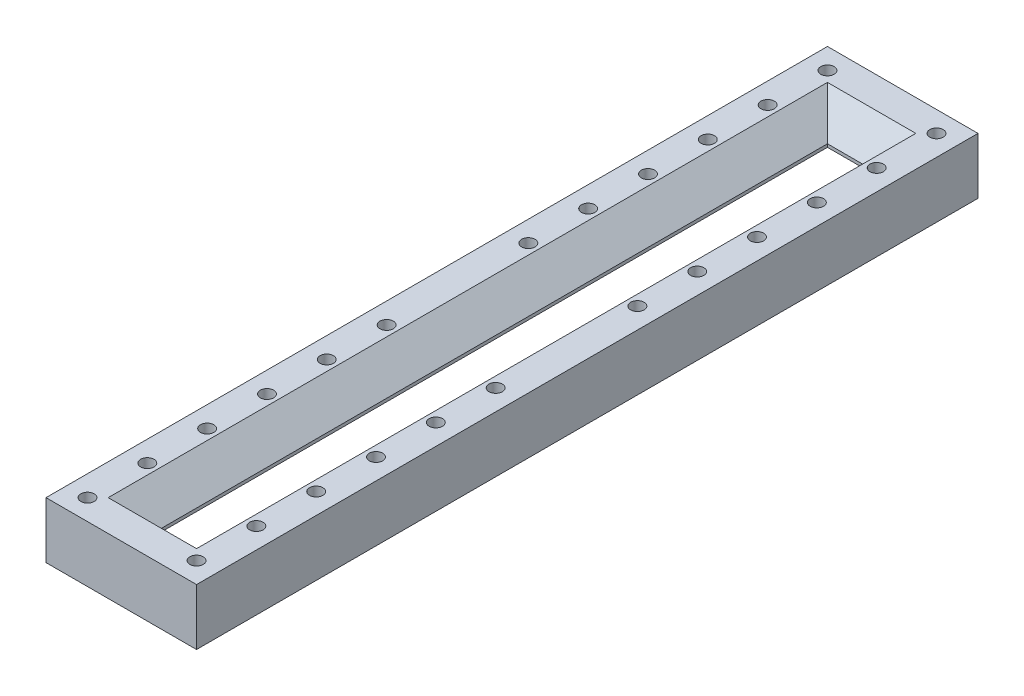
SolidWorks part; units mm, degrees
ref_plane "Front Plane" through (0, 0, 0) normal (1, 0, 0) x (0, 1, 0)
ref_plane "Top Plane" through (0, 0, 0) normal (0, 0, 1) x (0, 1, 0)
ref_plane "Right Plane" through (0, 0, 0) normal (0, 1, 0) x (-1, 0, 0)
sketch "beam" plane through (0, 0, 0) normal (0, 1, 0) x (-1, 0, 0)
  line L1 (-76.2, 1500) -> (76.2, 1500)
  line L2 (-76.2, 1500) -> (-76.2, -1500)
  line L3 (-76.2, -1500) -> (76.2, -1500)
  line L4 (76.2, 1500) -> (76.2, -1500)
  line L5 (-76.2, 1500) -> (76.2, -1500) construction
  line L6 (-76.2, -1500) -> (76.2, 1500) construction
  point P0 (0, 0)
  dimension "D1" = 3000
  dimension "D2" = 152.4
sketch "Sketch3" plane through (0, 0, 0) normal (0, 1, 0) x (-1, 0, 0)
  line L1 (-215.9, 1639.7) -> (215.9, 1639.7) construction
  line L2 (-215.9, 1639.7) -> (-215.9, -1639.7) construction
  line L3 (-215.9, -1639.7) -> (215.9, -1639.7) construction
  line L4 (215.9, 1639.7) -> (215.9, -1639.7) construction
  line L5 (-215.9, 1639.7) -> (215.9, -1639.7) construction
  line L6 (-215.9, -1639.7) -> (215.9, 1639.7) construction
  line L8 (-76.2, 1500) -> (76.2, 1500) construction
  line L9 (-76.2, 1500) -> (-76.2, -1500) construction
  circle A0 centre (-246.0625, 1669.8625) radius 30.1625
  circle A2 centre (246.0625, 1669.8625) radius 30.1625
  circle A3 centre (-246.0625, 1399.8625) radius 30.1625
  circle A4 centre (246.0625, 1399.8625) radius 30.1625
  circle A5 centre (-246.0625, 1129.8625) radius 30.1625
  circle A6 centre (246.0625, 1129.8625) radius 30.1625
  circle A7 centre (-246.0625, 859.8625) radius 30.1625
  circle A8 centre (246.0625, 859.8625) radius 30.1625
  circle A9 centre (-246.0625, 589.8625) radius 30.1625
  circle A10 centre (246.0625, 589.8625) radius 30.1625
  circle A11 centre (-246.0625, -1669.8625) radius 30.1625
  circle A12 centre (246.0625, -1669.8625) radius 30.1625
  circle A13 centre (-246.0625, -1399.8625) radius 30.1625
  circle A14 centre (246.0625, -1399.8625) radius 30.1625
  circle A15 centre (-246.0625, -1129.8625) radius 30.1625
  circle A16 centre (246.0625, -1129.8625) radius 30.1625
  circle A17 centre (-246.0625, -859.8625) radius 30.1625
  circle A18 centre (246.0625, -859.8625) radius 30.1625
  circle A19 centre (-246.0625, -589.8625) radius 30.1625
  circle A20 centre (246.0625, -589.8625) radius 30.1625
  circle A21 centre (-246.0625, -319.8625) radius 30.1625
  circle A22 centre (246.0625, -319.8625) radius 30.1625
  circle A25 centre (-246.0625, 319.8625) radius 30.1625
  circle A26 centre (246.0625, 319.8625) radius 30.1625
  point P2 (0, 0)
  dimension "D1" = 60.325
  dimension "D4" = 6
  dimension "D5" = 60.325
  dimension "D6" = 60.325
  dimension "D7" = 60.325
  dimension "D2" = 139.7
  dimension "D3" = 139.7
  dimension "D8" = 6
sketch "Sketch2" plane through (0, 0, 0) normal (0, 1, 0) x (-1, 0, 0)
  line L5 (-339.725, 1763.525) -> (339.725, 1763.525)
  line L6 (-339.725, 1763.525) -> (-339.725, -1763.525)
  line L7 (-339.725, -1763.525) -> (339.725, -1763.525)
  line L8 (79.375, 1503.175) -> (-79.375, 1503.175)
  line L9 (-79.375, 1503.175) -> (-79.375, -1503.175)
  line L10 (-79.375, -1503.175) -> (79.375, -1503.175)
  line L11 (79.375, -1503.175) -> (79.375, 1503.175)
  line L12 (79.375, 1503.175) -> (-79.375, 1503.175)
  line L13 (-79.375, 1503.175) -> (-79.375, -1503.175)
  line L14 (-79.375, -1503.175) -> (79.375, -1503.175)
  line L15 (79.375, -1503.175) -> (79.375, 1503.175)
  line L16 (339.725, 1763.525) -> (339.725, -1763.525)
  line L17 (-276.225, 1700.025) -> (276.225, 1700.025) construction
  line L18 (-276.225, 1700.025) -> (-276.225, -1700.025) construction
  line L19 (-276.225, -1700.025) -> (276.225, -1700.025) construction
  line L20 (276.225, 1700.025) -> (276.225, -1700.025) construction
  circle A0 centre (-246.0625, 1669.8625) radius 30.1625 construction
  circle A1 centre (-246.0625, 1399.8625) radius 30.1625 construction
  circle A2 centre (246.0625, 1669.8625) radius 30.1625 construction
  circle A3 centre (-246.0625, -1669.8625) radius 30.1625 construction
  dimension "D2" = 63.5
  dimension "D3" = 63.5
  dimension "D4" = 63.5
  dimension "D5" = 63.5
  dimension "D1" = 3.175
extrude "Boss-Extrude2" add sketch "Sketch2" along normal blind 254
extrude "Cut-Extrude1" cut sketch "Sketch3" along normal through all
chamfer "Chamfer1" distance 120 angle 45 8 edges at (79.375, 254, 0) (0, 254, -1503.175) (-79.375, 254, 0) (0, 254, 1503.175) (0, 0, -1503.175) (79.375, 0, 0) (-79.375, 0, 0) (0, 0, 1503.175)
